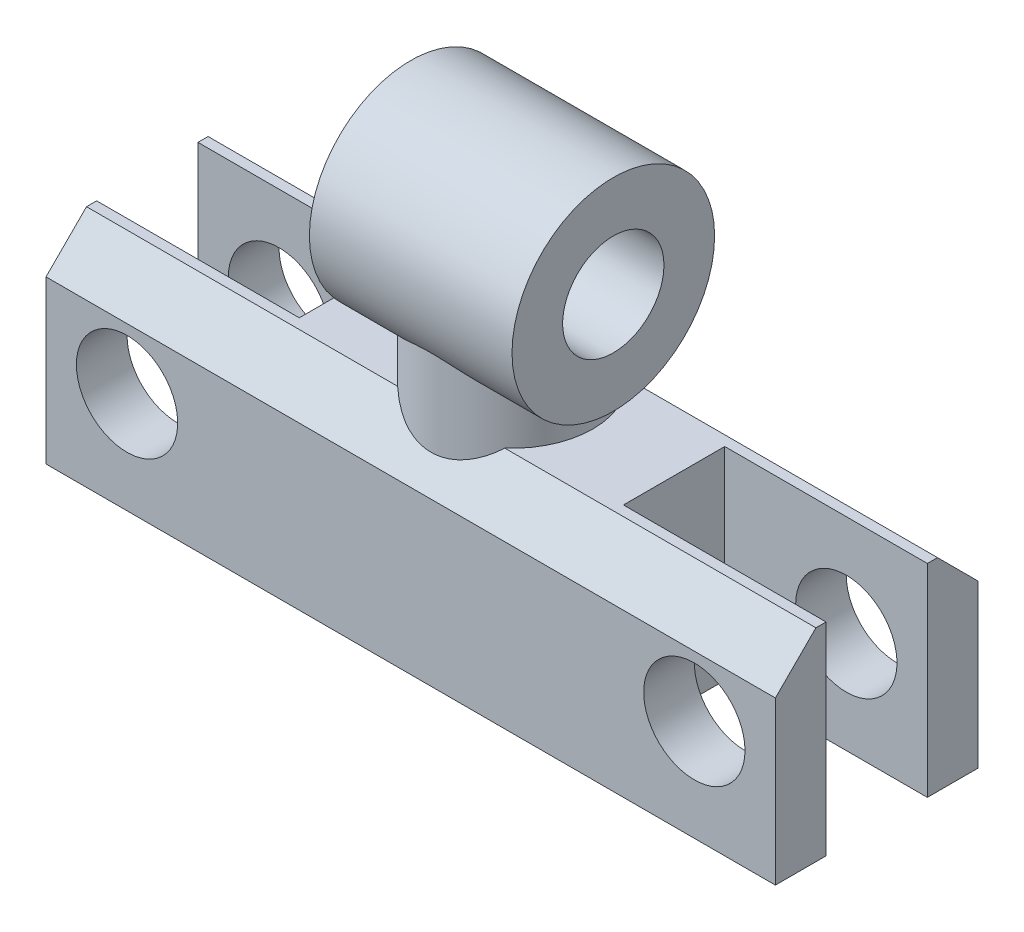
SolidWorks part; units mm, degrees
ref_plane "Plan de face" through (0, 0, 0) normal (0, 0, 1) x (1, 0, 0)
ref_plane "Plan de dessus" through (0, 0, 0) normal (0, 1, 0) x (1, 0, 0)
ref_plane "Plan de droite" through (0, 0, 0) normal (1, 0, 0) x (0, 0, -1)
sketch "Esquisse1" plane through (0, 0, 0) normal (0, 0, 1) x (1, 0, 0)
  line L0 (-18, 0) -> (18, 0)
  line L1 (18, 0) -> (18, 10)
  line L5 (18, 10) -> (-18, 10)
  line L6 (0, 10) -> (0, 0) construction
  line L7 (-8.4121, 16.25) -> (25.5479, 16.25) construction
  line L8 (-18, 0) -> (-18, 10)
  circle A0 centre (14, 5) radius 2.5
  circle A1 centre (-14, 5) radius 2.5
  dimension "D2" = 5
  dimension "D1" = 14
  dimension "D3" = 5
  dimension "D4" = 18
  dimension "D5" = 10
  dimension "D6" = 11.25
  dimension "D7" = 10
  dimension "D8" = 36
extrude "Boss.-Extru.1" add sketch "Esquisse1" along normal mid plane 10
sketch "Esquisse2" plane through (0, 10, 0) normal (0, 1, 0) x (1, 0, 0)
  line L0 (-18, -5) -> (-18, 5) construction
  line L1 (-18, 2.5) -> (-8, 2.5)
  line L2 (-18, 2.5) -> (-18, -2.5)
  line L3 (-18, -2.5) -> (-8, -2.5)
  line L4 (-8, 2.5) -> (-8, -2.5)
  line L5 (18, -5) -> (18, 5) construction
  line L6 (18, -2.5) -> (8, -2.5)
  line L7 (18, -2.5) -> (18, 2.5)
  line L8 (18, 2.5) -> (8, 2.5)
  line L9 (8, -2.5) -> (8, 2.5)
  dimension "D1" = 10
  dimension "D2" = 10
  dimension "D3" = 5
  dimension "D4" = 2.5
  dimension "D5" = 5
  dimension "D6" = 2.5
extrude "Enlèv. mat.-Extru.1" cut sketch "Esquisse2" against normal blind 10
sketch "Esquisse3" plane through (0, 0, 0) normal (1, 0, 0) x (0, 0, -1)
  circle A0 centre (0, 16.25) radius 5
  circle A1 centre (0, 16.25) radius 2.5
  dimension "D1" = 5
  dimension "D2" = 10
extrude "Boss.-Extru.2" add sketch "Esquisse3" along normal mid plane 10 separate body
sketch "Esquisse4" plane through (0, 10, 0) normal (0, 1, 0) x (1, 0, 0)
  circle A0 centre (0, 0) radius 4
  dimension "D1" = 8
extrude "Boss.-Extru.3" add sketch "Esquisse4" along normal up to next
chamfer "Chanfrein1" distance 2 angle 45 2 edges at (0, 10, -5) (0, 10, 5)
sketch "Esquisse5" plane through (0, 0, 0) normal (1, 0, 0) x (0, 0, -1)
  point P0 (0, 16.25)
